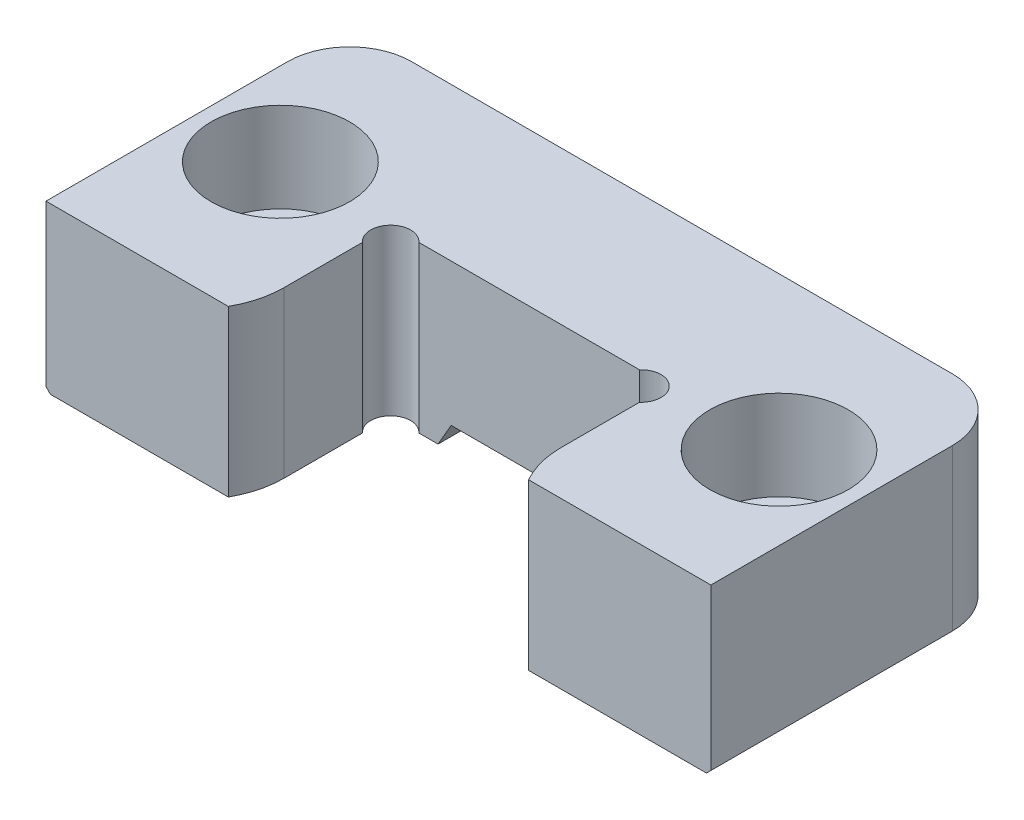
SolidWorks part; units mm, degrees
ref_plane "Front Plane" through (0, 0, 0) normal (0, 0, 1) x (1, 0, 0)
ref_plane "Top Plane" through (0, 0, 0) normal (0, 1, 0) x (1, 0, 0)
ref_plane "Right Plane" through (0, 0, 0) normal (1, 0, 0) x (0, 0, -1)
sketch "Sketch1" plane through (0, 0, 0) normal (0, 1, 0) x (1, 0, 0)
  line L0 (0, 0) -> (0, 50000) construction
  line L1 (0, 0) -> (50000, 0) construction
  line L2 (15.875, 0) -> (38.1, 0)
  line L3 (-38.1, 0) -> (-15.875, 0)
  line L4 (-38.1, 0) -> (-38.1, 34.798)
  line L5 (-38.1, 34.798) -> (38.1, 34.798)
  line L6 (38.1, 0) -> (38.1, 34.798)
  line L8 (-15.875, 0) -> (-15.875, 17.272)
  line L9 (-15.875, 17.272) -> (15.875, 17.272)
  line L10 (15.875, 0) -> (15.875, 17.272)
  dimension "D1" = 34.798
  dimension "D2" = 76.2
  dimension "D3" = 31.75
  dimension "D4" = 17.272
extrude "Boss-Extrude1" add sketch "Sketch1" against normal blind 18.923 separate body
fillet "Fillet1" radius 7.112 2 edges at (38.1, -9.4615, -34.798) (-38.1, -9.4615, -34.798)
sketch "Sketch2" plane through (0, 0, 0) normal (0, 1, 0) x (1, 0, 0)
  line L0 (0, 0) -> (0, 50000) construction
  line L1 (-15.875, 0) -> (-15.875, 17.272) construction
  line L2 (-38.1, 0) -> (-15.875, 0) construction
  line L3 (-15.875, 5.08) -> (-15.875, 12.7)
  line L4 (-28.575, 0) -> (-17.207, 0)
  line L5 (28.575, 0) -> (28.575, -12.7)
  line L6 (-28.575, -12.7) -> (28.575, -12.7)
  line L7 (-15.875, 12.7) -> (15.875, 12.7)
  line L8 (-28.575, 0) -> (-28.575, -12.7)
  line L9 (28.575, 0) -> (17.207, 0)
  line L10 (15.875, 5.08) -> (15.875, 12.7)
  arc A4 (17.207, 0) -> (15.875, 5.08) centre (26.2283, 5.08) cw
  arc A5 (-17.207, 0) -> (-15.875, 5.08) centre (-26.2283, 5.08) ccw
  point P14 (0, -12.7)
  point P24 (0, 12.7)
  dimension "D1" = 5.08
  dimension "D4" = 12.7
  dimension "D5" = 12.7
extrude "Cut-Extrude1" cut sketch "Sketch2" against normal through all
sketch "Sketch3" plane through (0, 0, 0) normal (0, 1, 0) x (1, 0, 0)
  line L2 (-16.637, 5.08) -> (-16.637, 17.272)
  line L3 (-16.637, 5.08) -> (-16.637, 17.272) construction
  line L4 (0, 0) -> (0, 50000) construction
  line L5 (-15.875, 18.034) -> (15.875, 18.034)
  line L6 (-15.875, 18.034) -> (15.875, 18.034) construction
  circle A0 centre (-14.351, 15.748) radius 2.286
  circle A1 centre (14.351, 15.748) radius 2.286
  dimension "D3" = 2.286
  dimension "D1" = 0.762
  dimension "D2" = 0.762
extrude "Cut-Extrude2" cut sketch "Sketch3" against normal through all
sketch "Sketch5" plane through (0, 0, -34.798) normal (0, 0, -1) x (-1, 0, 0)
  line L0 (-9.525, -17.3355) -> (9.525, -17.3355)
  line L1 (-30.988, 0) -> (30.988, 0) construction
  line L2 (0, 0) -> (0, 50000) construction
  line L3 (9.525, -17.3355) -> (10.4415, -18.923)
  line L4 (-30.988, -18.923) -> (30.988, -18.923) construction
  line L5 (-10.4415, -18.923) -> (10.4415, -18.923)
  line L6 (-9.525, -17.3355) -> (-10.4415, -18.923)
  point P4 (0, 0)
  point P12 (0, -18.923)
  point P13 (0, -17.3355)
  dimension "D1" = 30
  dimension "D2" = 1.5875
  dimension "D3" = 19.05
extrude "Cut-Extrude3" cut sketch "Sketch5" against normal through all
chamfer "Chamfer1" distance 0.508 angle 45 6 edges at (20.7148, -18.923, -34.798) (36.0169, -18.923, -32.7149) (38.1, -18.923, -13.843) (-20.7148, -18.923, -34.798) (-36.0169, -18.923, -32.7149) (-38.1, -18.923, -13.843)
chamfer "Chamfer5" distance 3.81 angle 15 1 edges at (0, -17.3355, -17.272)
hole_wizard "3/8\" CBORE" positions "Sketch7" profile "Sketch6" counterbore size "3/8" standard "ANSI Inch"
sketch "Sketch7" plane through (9.0831, 0, -5.226) normal (0, 1, 0) x (-1, 0, 0)
  line L0 (9.0831, 0) -> (9.0831, 50000) construction
  line L1 (-21.9049, -29.572) -> (40.0711, -29.572) construction
  line L2 (47.1831, -22.46) -> (47.1831, 5.226) construction
  point P0 (37.6581, -12.1095)
  point P11 (-19.4919, -12.1095)
  dimension "D1" = 9.525
  dimension "D2" = 17.4625
sketch "Sketch6" plane through (-28.575, 0, -17.3355) normal (1, 0, 0) x (0, 0, 1)
  line L0 (0, 0) -> (0, 18.923)
  line L1 (0, 18.923) -> (5.1587, 18.923)
  line L3 (5.1587, 18.923) -> (5.1587, 10.287)
  line L4 (5.1587, 10.287) -> (7.9375, 10.287)
  line L5 (7.9375, 10.287) -> (7.9375, 0)
  line L7 (7.9375, 0) -> (0, 0)
  line L11 (0, -6.35) -> (0, 107.95) construction
  dimension "Thru Hole Dia." = 10.3175
  dimension "Thru Hole Depth" = 18.923
  dimension "C'Bore Dia." = 15.875
  dimension "C'Bore Depth" = 10.287
